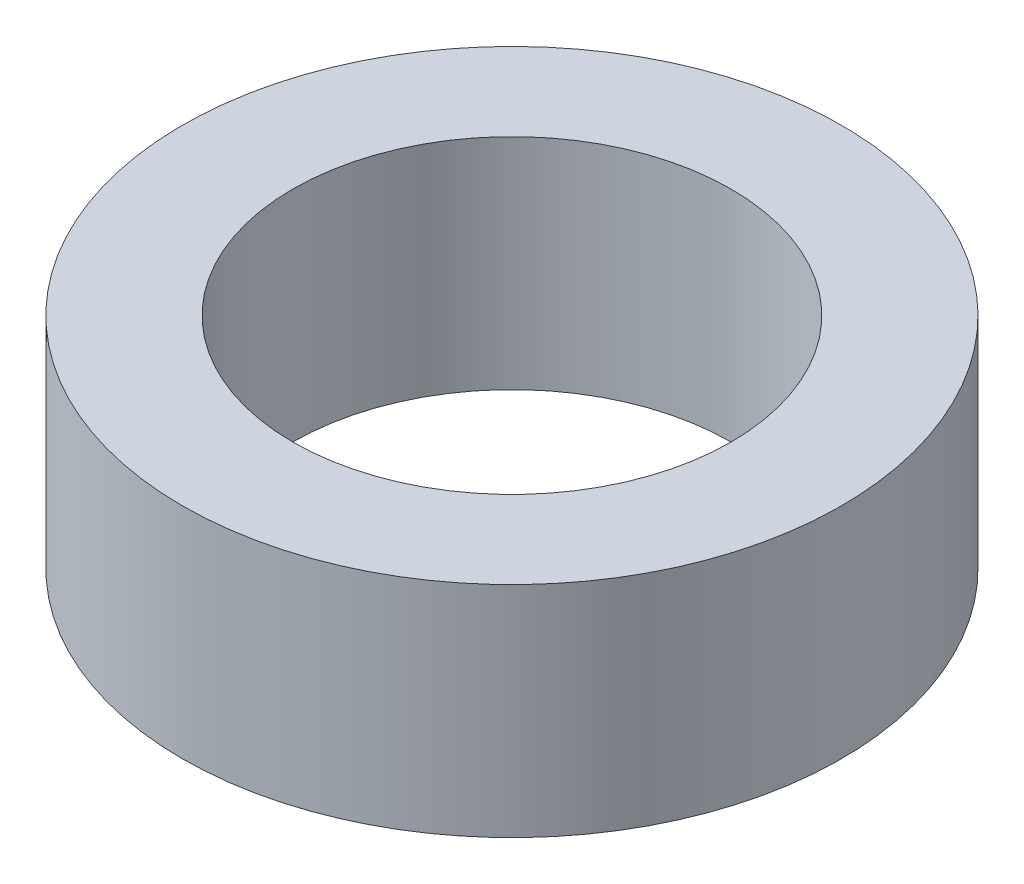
SolidWorks part; units mm, degrees
ref_plane "Front/Back" through (0, 0, 0) normal (0, 0, 1) x (1, 0, 0)
ref_plane "Top/Bottom" through (0, 0, 0) normal (0, 1, 0) x (1, 0, 0)
ref_plane "Right/Left" through (0, 0, 0) normal (1, 0, 0) x (0, 0, -1)
sketch "Sketch1" plane through (0, 0, 0) normal (0, 1, 0) x (1, 0, 0)
  circle A0 centre (0, 0) radius 2.3876
  circle A1 centre (0, 0) radius 1.5875
  dimension "D1" = 4.7752
  dimension "D2" = 3.175
extrude "Extrude1" add sketch "Sketch1" along normal mid plane 1.5875
